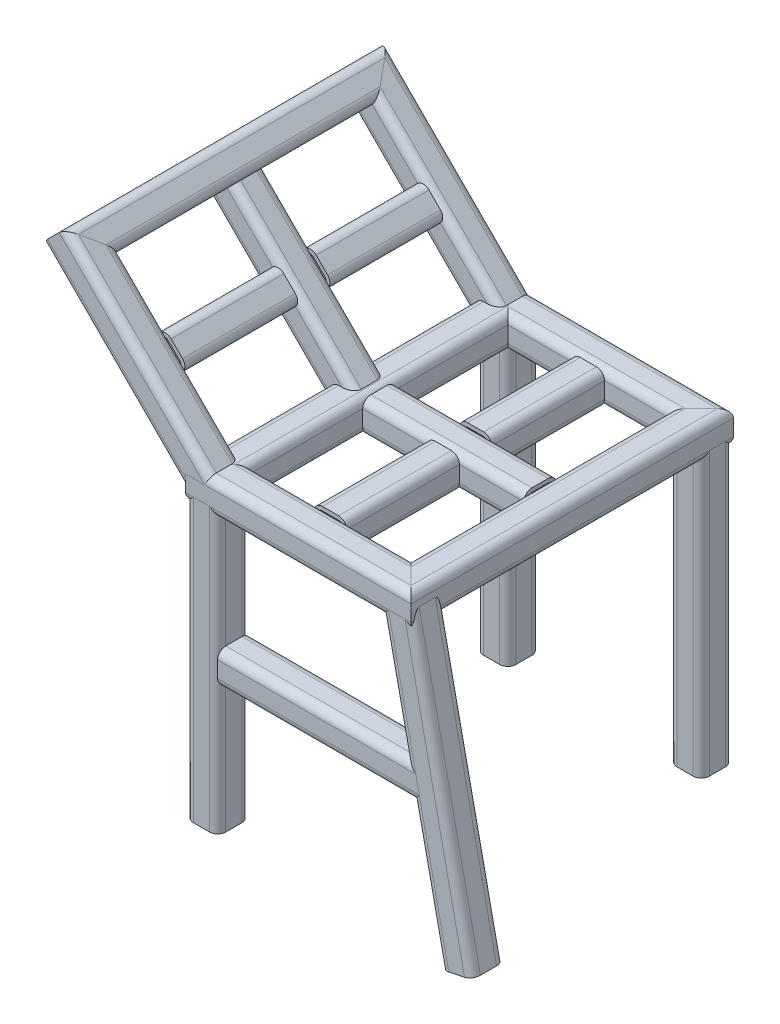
SolidWorks part; units mm, degrees
ref_plane "Front Plane" through (0, 0, 0) normal (0, 0, 1) x (1, 0, 0)
ref_plane "Top Plane" through (0, 0, 0) normal (0, 1, 0) x (1, 0, 0)
ref_plane "Right Plane" through (0, 0, 0) normal (1, 0, 0) x (0, 0, -1)
sketch "Sketch1" plane through (0, 0, 0) normal (0, 1, 0) x (1, 0, 0)
  line L0 (0, -457.2) -> (304.8, -457.2)
  line L1 (0, 0) -> (304.8, 0)
  line L2 (0, 0) -> (0, -457.2)
  line L3 (0, -228.6) -> (304.8, -228.6)
  line L4 (304.8, 0) -> (304.8, -457.2)
  line L5 (152.4, 0) -> (152.4, -228.6)
  line L6 (152.4, -228.6) -> (152.4, -457.2)
  dimension "D1" = 304.8
  dimension "D2" = 457.2
sketch3d "3DSketch1"
  line L0 (0, 0, 0) -> (-215.5261, 215.5261, 0)
  line L1 (-215.5261, 215.5261, 0) -> (-215.5261, 215.5261, 457.2)
  line L2 (-215.5261, 215.5261, 457.2) -> (0, 0, 457.2)
  line L3 (0, 0, 0) -> (0, 0, 457.2) construction
  line L4 (0, 0, 0) -> (304.8, 0, 0) construction
  line L5 (-107.7631, 107.7631, 0) -> (-107.7631, 107.7631, 457.2)
  line L6 (0, 0, 228.6) -> (-215.5261, 215.5261, 228.6)
  dimension "D1" = 304.8
  dimension "D2" = 135
  dimension "D3" = 152.4
sketch "Sketch2" plane through (0, 0, 0) normal (0, 0, 1) x (1, 0, 0)
  line L0 (0, 0) -> (0, -457.2)
  line L1 (304.8, 0) -> (304.8, -457.2)
  dimension "D1" = 457.2
ref_plane "Plane1" through (0, 0, 457.2) normal (0, 0, 1) x (1, 0, 0)
sketch "Sketch3" plane through (0, 0, 457.2) normal (0, 0, 1) x (1, 0, 0)
  line L0 (0, 0) -> (0, -457.2)
  line L1 (304.8, 0) -> (401.9809, -457.2)
  line L2 (0, -228.6) -> (353.3904, -228.6)
  dimension "D1" = 457.2
  dimension "D2" = 12
other "Structural Member1"
ref_plane "Plane10" through (0, 0, 0) normal (-0.7071, 0.7071, 0) x (0.5, 0.5, 0.7071)
sketch "Sketch111" plane through (0, 0, 0) normal (-0.7071, 0.7071, 0) x (0.5, 0.5, 0.7071)
  line L0 (-12.7, -19.05) -> (12.7, -19.05)
  line L1 (-19.05, -12.7) -> (-19.05, 12.7)
  line L2 (12.7, 19.05) -> (-12.7, 19.05)
  line L3 (19.05, 12.7) -> (19.05, -12.7)
  line L4 (-12.7, -25.4) -> (12.7, -25.4)
  line L5 (-25.4, -12.7) -> (-25.4, 12.7)
  line L6 (12.7, 25.4) -> (-12.7, 25.4)
  line L7 (25.4, 12.7) -> (25.4, -12.7)
  line L8 (0, 0) -> (19.05, 0) construction
  line L9 (0, 0) -> (0, 19.05) construction
  arc A0 (25.4, 12.7) -> (12.7, 25.4) centre (12.7, 12.7) ccw
  arc A1 (12.7, -25.4) -> (25.4, -12.7) centre (12.7, -12.7) ccw
  arc A2 (-25.4, -12.7) -> (-12.7, -25.4) centre (-12.7, -12.7) ccw
  arc A3 (-12.7, 25.4) -> (-25.4, 12.7) centre (-12.7, 12.7) ccw
  arc A4 (-12.7, 19.05) -> (-19.05, 12.7) centre (-12.7, 12.7) ccw
  arc A5 (19.05, 12.7) -> (12.7, 19.05) centre (12.7, 12.7) ccw
  arc A6 (12.7, -19.05) -> (19.05, -12.7) centre (12.7, -12.7) ccw
  arc A7 (-19.05, -12.7) -> (-12.7, -19.05) centre (-12.7, -12.7) ccw
  point P3 (0, 25.4)
  point P4 (25.4, 0)
  point P5 (0, -25.4)
  point P6 (-25.4, 0)
  point P7 (-25.4, 25.4)
  point P8 (-25.4, -25.4)
  point P33 (0, 0)
  point P35 (25.4, -25.4)
  point P36 (25.4, 25.4)
  point P37 (0, 0)
  dimension "D1" = 12.7
  dimension "Thickness" = 6.35
  dimension "V_leg" = 50.8
other "Structural Member2"
ref_plane "Plane6" through (0, 0, 457.2) normal (1, 0, 0) x (0, 0, -1)
sketch "Sketch15" plane through (0, 0, 457.2) normal (1, 0, 0) x (0, 0, -1)
  line L0 (-12.7, -19.05) -> (12.7, -19.05)
  line L1 (-19.05, -12.7) -> (-19.05, 12.7)
  line L2 (12.7, 19.05) -> (-12.7, 19.05)
  line L3 (19.05, 12.7) -> (19.05, -12.7)
  line L4 (-12.7, -25.4) -> (12.7, -25.4)
  line L5 (-25.4, -12.7) -> (-25.4, 12.7)
  line L6 (12.7, 25.4) -> (-12.7, 25.4)
  line L7 (25.4, 12.7) -> (25.4, -12.7)
  line L8 (0, 0) -> (19.05, 0) construction
  line L9 (0, 0) -> (0, 19.05) construction
  arc A0 (25.4, 12.7) -> (12.7, 25.4) centre (12.7, 12.7) ccw
  arc A1 (12.7, -25.4) -> (25.4, -12.7) centre (12.7, -12.7) ccw
  arc A2 (-25.4, -12.7) -> (-12.7, -25.4) centre (-12.7, -12.7) ccw
  arc A3 (-12.7, 25.4) -> (-25.4, 12.7) centre (-12.7, 12.7) ccw
  arc A4 (-12.7, 19.05) -> (-19.05, 12.7) centre (-12.7, 12.7) ccw
  arc A5 (19.05, 12.7) -> (12.7, 19.05) centre (12.7, 12.7) ccw
  arc A6 (12.7, -19.05) -> (19.05, -12.7) centre (12.7, -12.7) ccw
  arc A7 (-19.05, -12.7) -> (-12.7, -19.05) centre (-12.7, -12.7) ccw
  point P3 (0, 25.4)
  point P4 (25.4, 0)
  point P5 (0, -25.4)
  point P6 (-25.4, 0)
  point P7 (-25.4, 25.4)
  point P8 (-25.4, -25.4)
  point P33 (0, 0)
  point P35 (25.4, -25.4)
  point P36 (25.4, 25.4)
  point P37 (0, 0)
  dimension "D1" = 12.7
  dimension "Thickness" = 6.35
  dimension "V_leg" = 50.8
other "Structural Member3"
ref_plane "Plane7" through (0, 0, 0) normal (0, -1, 0) x (1, 0, 0)
sketch "Sketch16" plane through (0, 0, 0) normal (0, -1, 0) x (1, 0, 0)
  line L0 (-12.7, -19.05) -> (12.7, -19.05)
  line L1 (-19.05, -12.7) -> (-19.05, 12.7)
  line L2 (12.7, 19.05) -> (-12.7, 19.05)
  line L3 (19.05, 12.7) -> (19.05, -12.7)
  line L4 (-12.7, -25.4) -> (12.7, -25.4)
  line L5 (-25.4, -12.7) -> (-25.4, 12.7)
  line L6 (12.7, 25.4) -> (-12.7, 25.4)
  line L7 (25.4, 12.7) -> (25.4, -12.7)
  line L8 (0, 0) -> (19.05, 0) construction
  line L9 (0, 0) -> (0, 19.05) construction
  arc A0 (25.4, 12.7) -> (12.7, 25.4) centre (12.7, 12.7) ccw
  arc A1 (12.7, -25.4) -> (25.4, -12.7) centre (12.7, -12.7) ccw
  arc A2 (-25.4, -12.7) -> (-12.7, -25.4) centre (-12.7, -12.7) ccw
  arc A3 (-12.7, 25.4) -> (-25.4, 12.7) centre (-12.7, 12.7) ccw
  arc A4 (-12.7, 19.05) -> (-19.05, 12.7) centre (-12.7, 12.7) ccw
  arc A5 (19.05, 12.7) -> (12.7, 19.05) centre (12.7, 12.7) ccw
  arc A6 (12.7, -19.05) -> (19.05, -12.7) centre (12.7, -12.7) ccw
  arc A7 (-19.05, -12.7) -> (-12.7, -19.05) centre (-12.7, -12.7) ccw
  point P3 (0, 25.4)
  point P4 (25.4, 0)
  point P5 (0, -25.4)
  point P6 (-25.4, 0)
  point P7 (-25.4, 25.4)
  point P8 (-25.4, -25.4)
  point P33 (0, 0)
  point P35 (25.4, -25.4)
  point P36 (25.4, 25.4)
  point P37 (0, 0)
  dimension "D1" = 12.7
  dimension "Thickness" = 6.35
  dimension "V_leg" = 50.8
other "Structural Member4"
ref_plane "Plane8" through (0, 0, 457.2) normal (0, -1, 0) x (1, 0, 0)
sketch "Sketch17" plane through (0, 0, 457.2) normal (0, -1, 0) x (1, 0, 0)
  line L0 (-12.7, -19.05) -> (12.7, -19.05)
  line L1 (-19.05, -12.7) -> (-19.05, 12.7)
  line L2 (12.7, 19.05) -> (-12.7, 19.05)
  line L3 (19.05, 12.7) -> (19.05, -12.7)
  line L4 (-12.7, -25.4) -> (12.7, -25.4)
  line L5 (-25.4, -12.7) -> (-25.4, 12.7)
  line L6 (12.7, 25.4) -> (-12.7, 25.4)
  line L7 (25.4, 12.7) -> (25.4, -12.7)
  line L8 (0, 0) -> (19.05, 0) construction
  line L9 (0, 0) -> (0, 19.05) construction
  arc A0 (25.4, 12.7) -> (12.7, 25.4) centre (12.7, 12.7) ccw
  arc A1 (12.7, -25.4) -> (25.4, -12.7) centre (12.7, -12.7) ccw
  arc A2 (-25.4, -12.7) -> (-12.7, -25.4) centre (-12.7, -12.7) ccw
  arc A3 (-12.7, 25.4) -> (-25.4, 12.7) centre (-12.7, 12.7) ccw
  arc A4 (-12.7, 19.05) -> (-19.05, 12.7) centre (-12.7, 12.7) ccw
  arc A5 (19.05, 12.7) -> (12.7, 19.05) centre (12.7, 12.7) ccw
  arc A6 (12.7, -19.05) -> (19.05, -12.7) centre (12.7, -12.7) ccw
  arc A7 (-19.05, -12.7) -> (-12.7, -19.05) centre (-12.7, -12.7) ccw
  point P3 (0, 25.4)
  point P4 (25.4, 0)
  point P5 (0, -25.4)
  point P6 (-25.4, 0)
  point P7 (-25.4, 25.4)
  point P8 (-25.4, -25.4)
  point P33 (0, 0)
  point P35 (25.4, -25.4)
  point P36 (25.4, 25.4)
  point P37 (0, 0)
  dimension "D1" = 12.7
  dimension "Thickness" = 6.35
  dimension "V_leg" = 50.8
other "Structural Member5"
ref_plane "Plane9" through (304.8, 0, 457.2) normal (0.2079, -0.9781, 0) x (0.9781, 0.2079, 0)
sketch "Sketch18" plane through (304.8, 0, 457.2) normal (0.2079, -0.9781, 0) x (0.9781, 0.2079, 0)
  line L0 (-12.7, -19.05) -> (12.7, -19.05)
  line L1 (-19.05, -12.7) -> (-19.05, 12.7)
  line L2 (12.7, 19.05) -> (-12.7, 19.05)
  line L3 (19.05, 12.7) -> (19.05, -12.7)
  line L4 (-12.7, -25.4) -> (12.7, -25.4)
  line L5 (-25.4, -12.7) -> (-25.4, 12.7)
  line L6 (12.7, 25.4) -> (-12.7, 25.4)
  line L7 (25.4, 12.7) -> (25.4, -12.7)
  line L8 (0, 0) -> (19.05, 0) construction
  line L9 (0, 0) -> (0, 19.05) construction
  arc A0 (25.4, 12.7) -> (12.7, 25.4) centre (12.7, 12.7) ccw
  arc A1 (12.7, -25.4) -> (25.4, -12.7) centre (12.7, -12.7) ccw
  arc A2 (-25.4, -12.7) -> (-12.7, -25.4) centre (-12.7, -12.7) ccw
  arc A3 (-12.7, 25.4) -> (-25.4, 12.7) centre (-12.7, 12.7) ccw
  arc A4 (-12.7, 19.05) -> (-19.05, 12.7) centre (-12.7, 12.7) ccw
  arc A5 (19.05, 12.7) -> (12.7, 19.05) centre (12.7, 12.7) ccw
  arc A6 (12.7, -19.05) -> (19.05, -12.7) centre (12.7, -12.7) ccw
  arc A7 (-19.05, -12.7) -> (-12.7, -19.05) centre (-12.7, -12.7) ccw
  point P3 (0, 25.4)
  point P4 (25.4, 0)
  point P5 (0, -25.4)
  point P6 (-25.4, 0)
  point P7 (-25.4, 25.4)
  point P8 (-25.4, -25.4)
  point P33 (0, 0)
  point P35 (25.4, -25.4)
  point P36 (25.4, 25.4)
  point P37 (0, 0)
  dimension "D1" = 12.7
  dimension "Thickness" = 6.35
  dimension "V_leg" = 50.8
